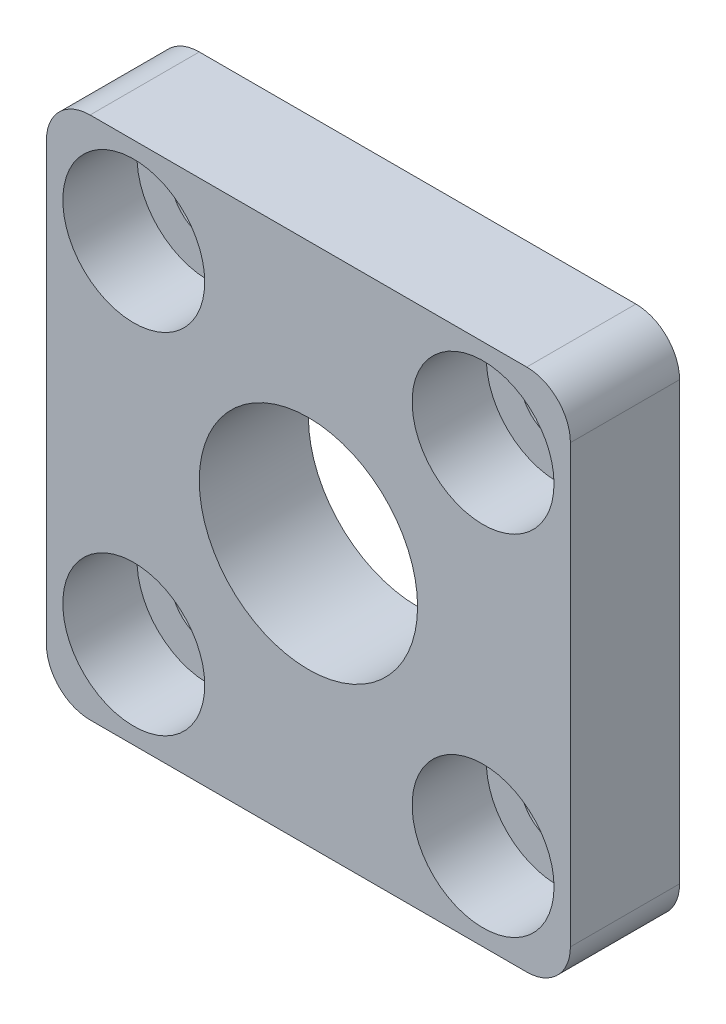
SolidWorks part; units mm, degrees
ref_plane "Ebene vorne" through (0, 0, 0) normal (0, 0, 1) x (1, 0, 0)
ref_plane "Ebene oben" through (0, 0, 0) normal (0, 1, 0) x (1, 0, 0)
ref_plane "Ebene rechts" through (0, 0, 0) normal (1, 0, 0) x (0, 0, -1)
sketch "Skizze1" plane through (0, 0, 0) normal (0, 0, 1) x (1, 0, 0)
  line L1 (-12, -12) -> (12, -12)
  line L2 (-12, -12) -> (-12, 12)
  line L3 (-12, 12) -> (12, 12)
  line L4 (12, -12) -> (12, 12)
  line L5 (-12, -12) -> (12, 12) construction
  line L6 (-12, 12) -> (12, -12) construction
  circle A0 centre (0, 0) radius 5
  point P0 (0, 0)
  dimension "D3" = 10
  dimension "D1" = 24
  dimension "D2" = 24
extrude "Aufsatz-Linear austragen1" add sketch "Skizze1" along normal blind 5
hole_wizard "Stirnsenkung für M3 Zylinderschraube mit Innensechskant1" positions "Skizze2" profile "Skizze3" counterbore size "M3" standard "DIN"
sketch "Skizze2" plane through (0, 0, 5) normal (0, 0, 1) x (1, 0, 0)
  line L0 (-12, 12) -> (-12, -12) construction
  line L1 (12, 12) -> (-12, 12) construction
  line L2 (-12, -12) -> (12, -12) construction
  line L3 (12, -12) -> (12, 12) construction
  point P0 (-8, 8)
  point P2 (8, 8)
  point P4 (8, -8)
  point P6 (-8, -8)
  dimension "D1" = 4
  dimension "D2" = 4
  dimension "D3" = 4
  dimension "D4" = 4
sketch "Skizze3" plane through (-8, 8, 5) normal (1, 0, 0) x (0, -1, 0)
  line L0 (0, 0) -> (0, 5)
  line L1 (0, 5) -> (1.7, 5)
  line L3 (1.7, 5) -> (1.7, 3.4)
  line L4 (1.7, 3.4) -> (3.25, 3.4)
  line L5 (3.25, 3.4) -> (3.25, 0)
  line L7 (3.25, 0) -> (0, 0)
  line L11 (0, -6.35) -> (0, 107.95) construction
  dimension "Bohrerdurchmesser" = 3.4
  dimension "Bohrungstiefe" = 5
  dimension "Senkdurchmesser2" = 6.5
  dimension "Senktiefe2" = 3.4
fillet "Verrundung1" radius 2 4 edges at (-12, -12, 2.5) (12, -12, 2.5) (-12, 12, 2.5) (12, 12, 2.5)
